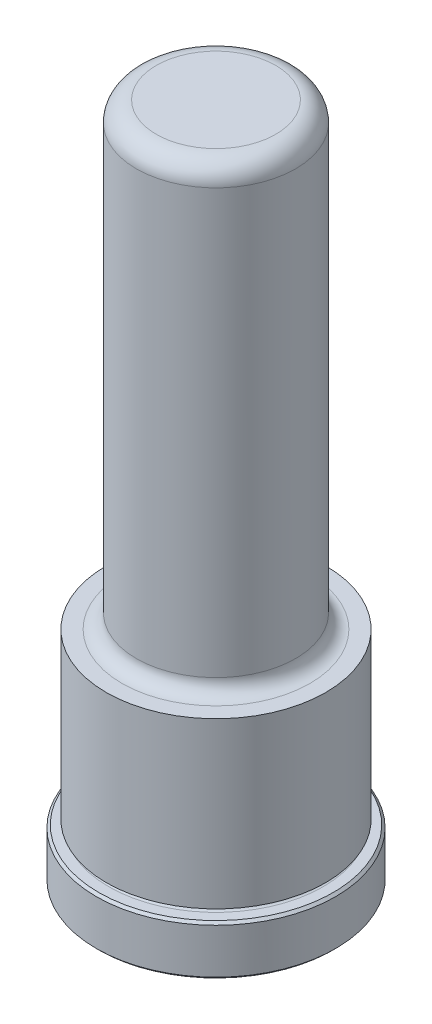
SolidWorks part; units mm, degrees
ref_plane "Front Plane" through (0, 0, 0) normal (0, 0, 1) x (1, 0, 0)
ref_plane "Top Plane" through (0, 0, 0) normal (0, 1, 0) x (1, 0, 0)
ref_plane "Right Plane" through (0, 0, 0) normal (1, 0, 0) x (0, 0, -1)
sketch "Sketch1" plane through (0, 0, 0) normal (1, 0, 0) x (0, 0, -1)
  line L0 (0, 0) -> (19.05, 0)
  line L1 (19.05, 0) -> (19.05, 7.9248)
  line L2 (19.05, 7.9248) -> (17.0688, 7.9248)
  line L3 (16.6878, 2.6782) -> (16.6878, 5.9795) construction
  line L4 (17.0688, 8.6868) -> (17.4752, 8.6868)
  line L5 (17.4752, 8.6868) -> (17.4752, 34.925)
  line L6 (17.4752, 34.925) -> (14.9733, 34.925)
  line L7 (12.6873, 37.211) -> (12.6873, 107.95)
  line L9 (12.6873, 107.95) -> (0, 107.95)
  line L10 (0, 107.95) -> (0, 0)
  line L11 (0, 0) -> (0, -7.2694) construction
  arc A0 (17.0688, 8.6868) -> (17.0688, 7.9248) centre (17.0688, 8.3058) ccw
  arc A1 (14.9733, 34.925) -> (12.6873, 37.211) centre (14.9733, 37.211) cw
  point P2 (12.6873, 107.95)
  point P14 (12.6873, 107.8141)
  point P19 (12.6873, 34.925)
  dimension "D14" = 0.762
  dimension "D8" = 2.286
  dimension "T" = 7.9248
  dimension "D2" = 0.762
  dimension "M" = 38.1
  dimension "B" = 34.9504
  dimension "L" = 107.95
  dimension "D7" = 0.7874
  dimension "A" = 34.925
  dimension "D" = 25.3746
  dimension "D15" = 73.025
revolve "Revolve1" add sketch "Sketch1" angle 360 about L11
chamfer "Chamfer1" distance 0.381 angle 45 2 edges at (0, 0, 19.05) (0, 7.9248, 19.05)
fillet "Fillet7" radius 3.175 1 edges at (0, 107.95, 12.6873)
